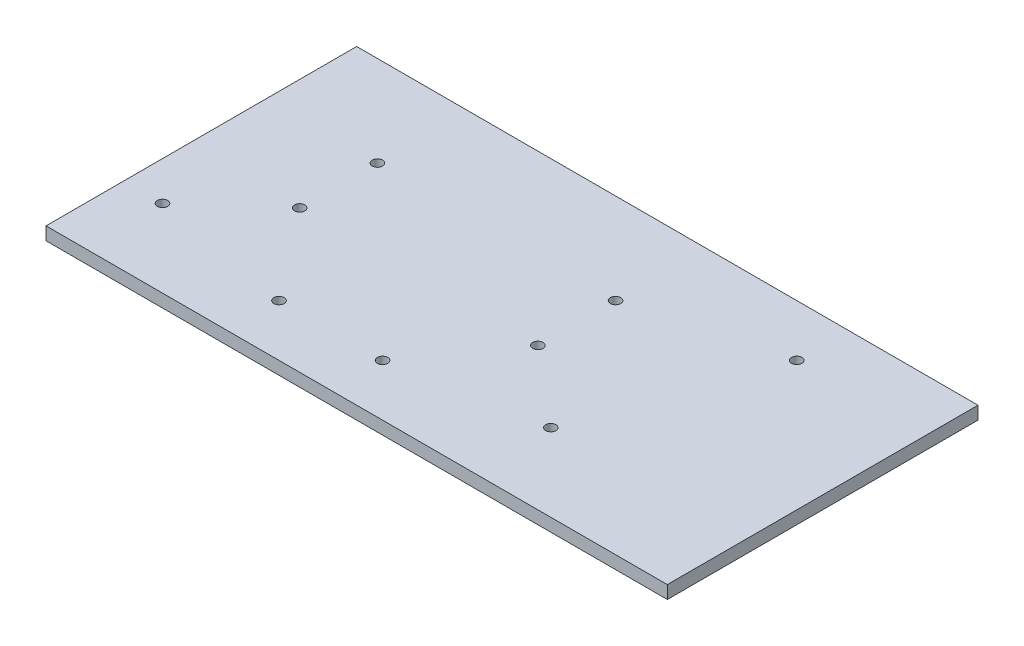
SolidWorks part; units mm, degrees
ref_plane "Front" through (0, 0, 0) normal (0, 0, 1) x (1, 0, 0)
ref_plane "Top" through (0, 0, 0) normal (0, 1, 0) x (1, 0, 0)
ref_plane "Right" through (0, 0, 0) normal (1, 0, 0) x (0, 0, -1)
sketch "Sketch1" plane through (0, 0, 0) normal (0, 1, 0) x (1, 0, 0)
  line L1 (0, 0) -> (240, 0)
  line L2 (0, 0) -> (0, 120)
  line L3 (0, 120) -> (240, 120)
  line L4 (240, 0) -> (240, 120)
  circle A0 centre (15, 30) radius 2
  circle A1 centre (70, 20) radius 2
  circle A2 centre (110, 20) radius 2
  circle A3 centre (165, 30) radius 2
  circle A4 centre (190, 100) radius 2
  circle A5 centre (135, 85) radius 2
  circle A6 centre (43, 85) radius 2
  circle A7 centre (43, 55) radius 2
  circle A8 centre (135, 55) radius 2
extrude "Extrude1" add sketch "Sketch1" along normal blind 5
